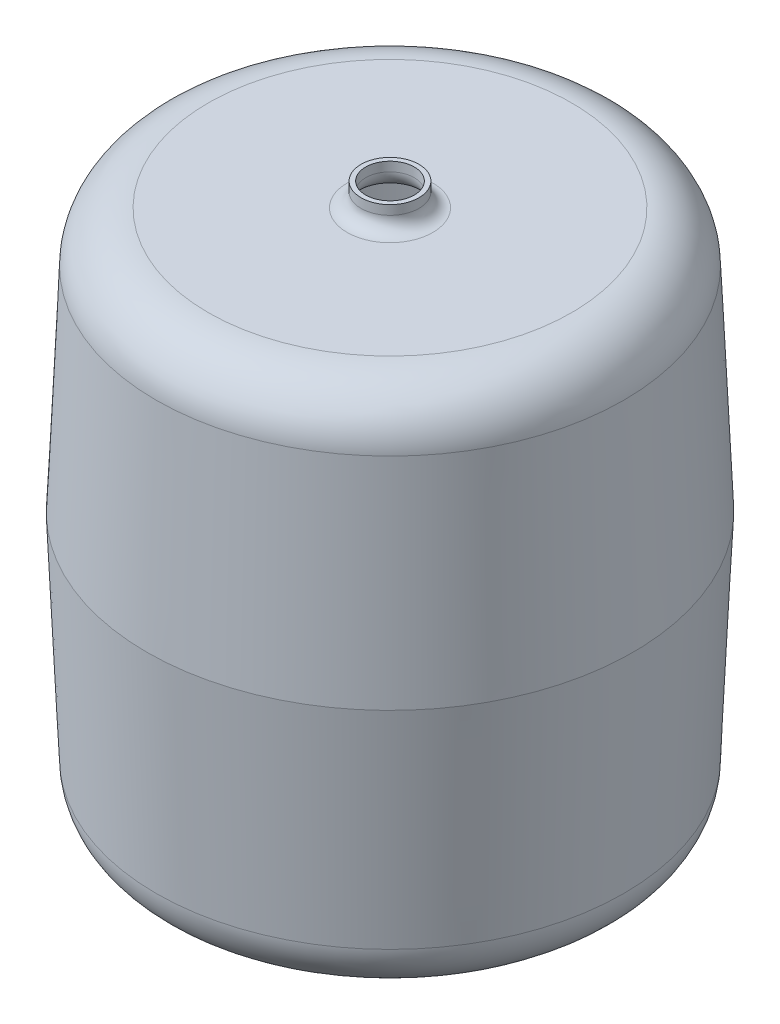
SolidWorks part; units mm, degrees
ref_plane "前视基准面" through (0, 0, 0) normal (0, 0, 1) x (1, 0, 0)
ref_plane "上视基准面" through (0, 0, 0) normal (0, 1, 0) x (1, 0, 0)
ref_plane "右视基准面" through (0, 0, 0) normal (1, 0, 0) x (0, 0, -1)
other "Configuration Table"
sketch "草图1" plane through (0, 0, 0) normal (0, 0, 1) x (1, 0, 0)
  line L0 (0, 0) -> (0, -475) construction
  line L1 (0, -475) -> (-156.9219, -475)
  line L2 (-201.879, -431.9629) -> (-209.9329, -247.5)
  line L3 (-209.9329, -247.5) -> (-201.879, -63.0371)
  line L4 (-156.9219, -20) -> (-37, -20)
  line L5 (-25, -8) -> (-25, 0)
  line L6 (-25, 0) -> (-21, 0)
  line L7 (0, -471) -> (-156.9219, -471)
  line L8 (-197.8828, -431.7884) -> (-205.9291, -247.5)
  line L9 (-205.9291, -247.5) -> (-197.8828, -63.2116)
  line L10 (-156.9219, -24) -> (-37, -24)
  line L11 (-21, -8) -> (-21, -4)
  line L13 (-21, -4) -> (-21, 0)
  line L14 (-25, 0) -> (0, 0) construction
  line L15 (-21, -4) -> (0, -4) construction
  line L16 (0, -471) -> (0, -475)
  arc A0 (-37, -20) -> (-25, -8) centre (-37, -8) ccw
  arc A1 (-201.879, -63.0371) -> (-156.9219, -20) centre (-156.9219, -65) cw
  arc A2 (-156.9219, -475) -> (-201.879, -431.9629) centre (-156.9219, -430) cw
  arc A3 (-156.9219, -471) -> (-197.8828, -431.7884) centre (-156.9219, -430) cw
  arc A4 (-197.8828, -63.2116) -> (-156.9219, -24) centre (-156.9219, -65) cw
  arc A5 (-37, -24) -> (-21, -8) centre (-37, -8) ccw
  point P17 (-200, -475)
  dimension "D5" = 12
  dimension "D8" = 45
  dimension "D1" = 92.5
  dimension "D2" = 92.5
  dimension "D3" = 455
  dimension "D4" = 25
  dimension "D6" = 200
  dimension "D7" = 20
  dimension "D9" = 4
revolve "旋转3" add sketch "草图1" angle 360 about L16
